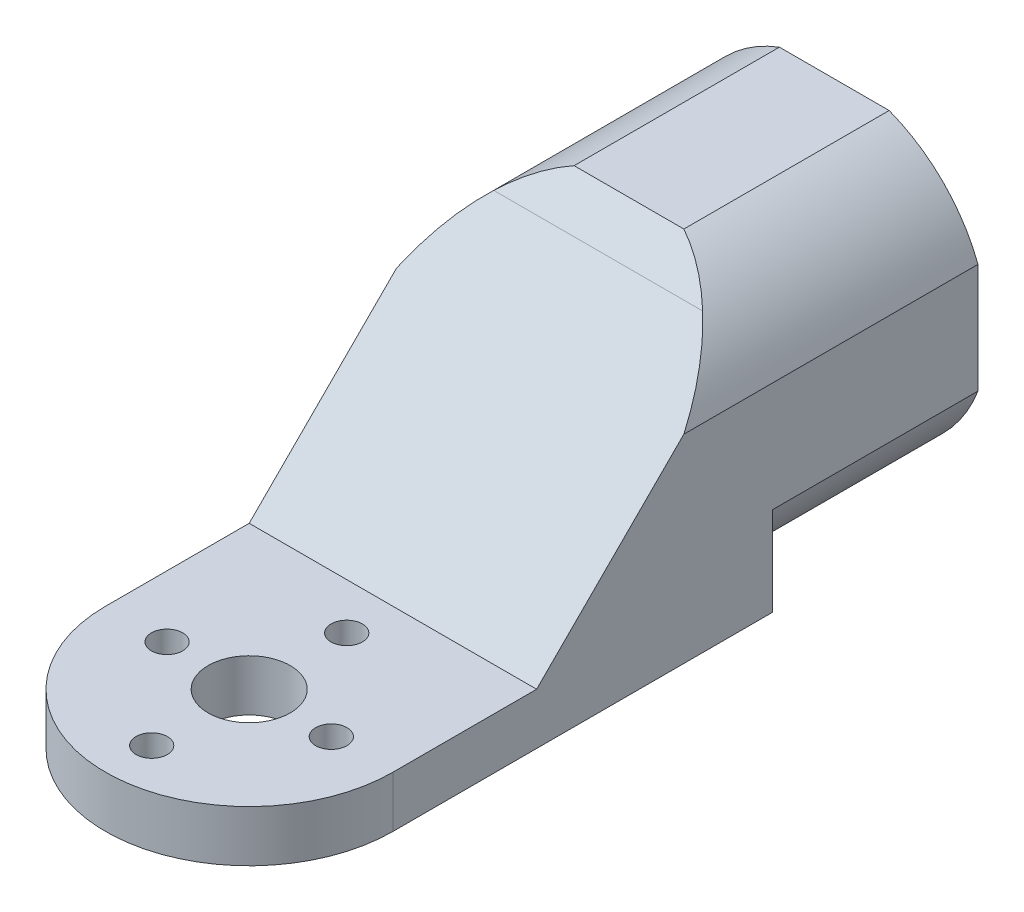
SolidWorks part; units mm, degrees
ref_plane "Front Plane" through (0, 0, 0) normal (0, 0, 1) x (1, 0, 0)
ref_plane "Top Plane" through (0, 0, 0) normal (0, 1, 0) x (1, 0, 0)
ref_plane "Right Plane" through (0, 0, 0) normal (1, 0, 0) x (0, 0, -1)
sketch "Sketch1" plane through (0, 0, 0) normal (0, 1, 0) x (1, 0, 0)
  line L0 (0, 9.5) -> (0, -9.5)
  line L1 (-8, 0) -> (8, 0)
  line L2 (14, 14) -> (-14, 14)
  line L3 (-14, 14) -> (-14, 0)
  line L4 (14, 14) -> (14, 0)
  line L6 (-14, 14) -> (14, 14)
  line L7 (-14, 14) -> (-14, 34)
  line L8 (-14, 34) -> (14, 34)
  line L9 (14, 14) -> (14, 34)
  circle A0 centre (0, 0) radius 14
  circle A1 centre (0, 9.5) radius 1.525
  circle A2 centre (8, 0) radius 1.525
  circle A3 centre (0, -9.5) radius 1.525
  circle A4 centre (-8, 0) radius 1.525
  circle A5 centre (0, 0) radius 4
  dimension "D3" = 3.05
  dimension "D4" = 8
  dimension "D5" = 28
  dimension "D1" = 19
  dimension "D2" = 16
  dimension "D6" = 14
  dimension "D7" = 28
  dimension "D8" = 20
extrude "Boss-Extrude1" add sketch "Sketch1" along normal blind 5
sketch "Sketch2" plane through (0, 0, -34) normal (0, 0, -1) x (-1, 0, 0)
  line L0 (14, 5) -> (14, 0) construction
  line L1 (-14, 0) -> (14, 0)
  line L2 (-14, 0) -> (-14, 28)
  line L3 (-14, 28) -> (14, 28)
  line L4 (14, 0) -> (14, 28)
extrude "Boss-Extrude2" add sketch "Sketch2" along normal blind 3
chamfer "Chamfer1" distance 20 angle 45 1 edges
chamfer "Chamfer2" distance 3 angle 45 1 edges at (0, 28, -34)
sketch "Sketch3" plane through (0, 0, -37) normal (0, 0, -1) x (-1, 0, 0)
  line L0 (0, 28) -> (0, 0) construction
  line L1 (14, 28) -> (-14, 28) construction
  line L2 (-14, 0) -> (14, 0) construction
  line L3 (-14, 14) -> (14, 14) construction
  line L4 (-14, 28) -> (-14, 0) construction
  line L5 (14, 0) -> (14, 28) construction
  line L6 (-5.346, 0) -> (5.346, 0)
  line L7 (-14, 19.346) -> (-14, 8.654)
  line L8 (14, 8.654) -> (14, 19.346)
  line L9 (5.346, 28) -> (-5.346, 28)
  circle A0 centre (0, 14) radius 14.986
  dimension "D1" = 29.972
extrude "Boss-Extrude3" add sketch "Sketch3" along normal blind 20 contours A0 M5 M6 M3 M4
sketch "Sketch4" plane through (0, 0, -37) normal (0, 0, -1) x (-1, 0, 0)
  line L0 (-5.346, 28) -> (-14, 28) construction
  line L1 (-14, 28) -> (-14, 19.346) construction
  line L2 (14, 19.346) -> (14, 28) construction
  line L3 (14, 28) -> (5.346, 28) construction
  line L4 (-5.346, 28) -> (-14, 28)
  line L5 (-14, 28) -> (-14, 19.346)
  line L6 (14, 19.346) -> (14, 28)
  line L7 (14, 28) -> (5.346, 28)
  arc A0 (-5.346, 28) -> (-14, 19.346) centre (0, 14) ccw construction
  arc A1 (14, 19.346) -> (5.346, 28) centre (0, 14) ccw construction
  arc A2 (-5.346, 28) -> (-14, 19.346) centre (0, 14) ccw
  arc A3 (14, 19.346) -> (5.346, 28) centre (0, 14) ccw
extrude "Cut-Extrude1" cut sketch "Sketch4" against normal blind 20
